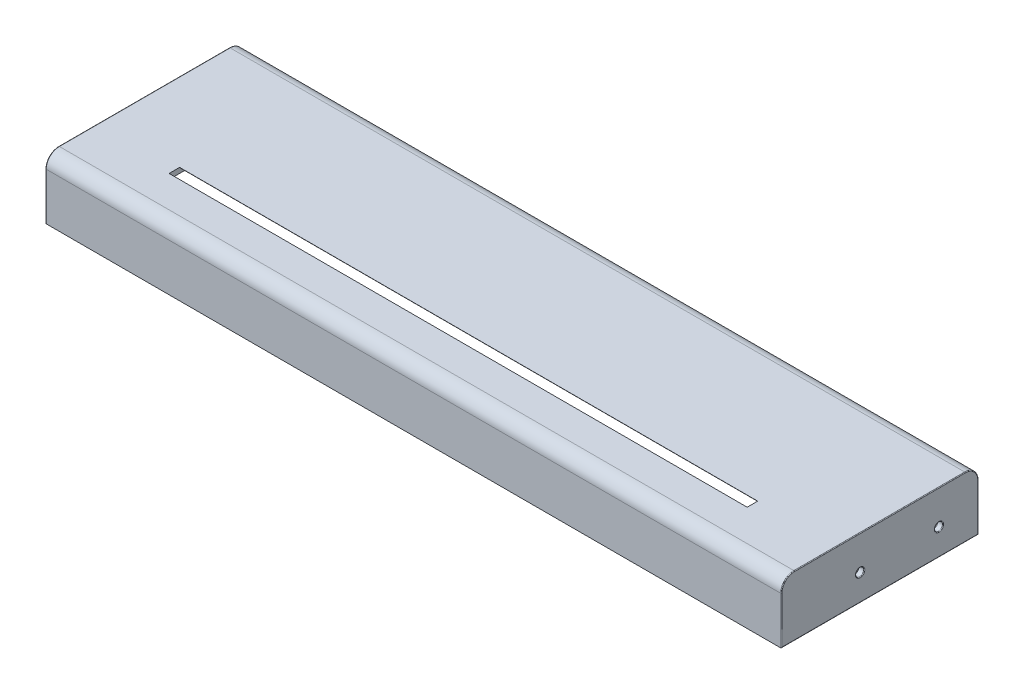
SolidWorks part; units mm, degrees
ref_plane "Piano frontale" through (0, 0, 0) normal (0, 0, 1) x (1, 0, 0)
ref_plane "Piano superiore" through (0, 0, 0) normal (0, 1, 0) x (1, 0, 0)
ref_plane "Piano destro" through (0, 0, 0) normal (1, 0, 0) x (0, 0, -1)
sketch "Schizzo1" plane through (0, 0, 0) normal (1, 0, 0) x (0, 0, -1)
  line L0 (-7.5, 10) -> (22.5, 10) construction
  line L1 (-32.5, 34) -> (32.5, 34)
  line L2 (-37.5, 29) -> (-37.5, 11)
  line L3 (7.5, 0) -> (7.5, 10) construction
  line L4 (37.5, 29) -> (37.5, 11)
  line L5 (-37.5, 0) -> (37.5, 0) construction
  line L6 (-37.5, 11) -> (37.5, 11)
  line L7 (37.5, 11) -> (37.5, 0) construction
  line L8 (-37.5, 0) -> (-37.5, 11) construction
  circle A0 centre (-7.5, 10) radius 1.55 construction
  arc A1 (-32.5, 34) -> (-37.5, 29) centre (-32.5, 29) ccw
  arc A2 (32.5, 34) -> (37.5, 29) centre (32.5, 29) cw
  circle A3 centre (22.5, 10) radius 1.55 construction
  point P1 (0, 0)
  dimension "D1" = 34
  dimension "D3" = 5
  dimension "D4" = 3.1
  dimension "D2" = 75
  dimension "D5" = 10
  dimension "D6" = 30
  dimension "D7" = 30
  dimension "D8" = 11
extrude "Estrusione-Estrusione1" add sketch "Schizzo1" along normal blind 280
shell "Svuota1" thickness 2
sketch "Schizzo2" plane through (0, 34, 0) normal (0, 1, 0) x (1, 0, 0)
  line L0 (140, -18.5) -> (140, 37.5) construction
  line L1 (30, -20.5) -> (250, -20.5)
  line L2 (30, -20.5) -> (30, -16.5)
  line L3 (30, -16.5) -> (250, -16.5)
  line L4 (250, -20.5) -> (250, -16.5)
  line L5 (30, -20.5) -> (250, -16.5) construction
  line L6 (30, -16.5) -> (250, -20.5) construction
  line L7 (280, 37.5) -> (0, 37.5) construction
  point P0 (140, -18.5)
  dimension "D1" = 4
  dimension "D2" = 220
  dimension "D3" = 56
extrude "Taglio-Estrusione1" cut sketch "Schizzo2" against normal blind 10
sketch "Schizzo3" plane through (280, 0, 0) normal (1, 0, 0) x (0, 0, -1)
  line L0 (-7.5, 21) -> (22.5, 21) construction
  line L1 (7.5, 21) -> (7.5, 0) construction
  line L3 (37.5, 11) -> (37.5, 0) construction
  line L4 (37.5, 0) -> (7.5, 0) construction
  circle A0 centre (22.5, 21) radius 1.55
  circle A1 centre (-7.5, 21) radius 1.55
  dimension "D1" = 3.1
  dimension "D2" = 30
  dimension "D3" = 21
extrude "Taglio-Estrusione2" cut sketch "Schizzo3" against normal up to next
fillet "Raccordo1" radius 5 2 edges at (140, 32, 20.5) (140, 32, 16.5)
sketch "Schizzo4" plane through (0, 0, 0) normal (-1, 0, 0) x (0, 0, 1)
  line L0 (-22.5, 21) -> (7.5, 21) construction
  line L1 (-7.5, 21) -> (-7.5, 0) construction
  line L3 (0, 0) -> (-7.5, 0) construction
  circle A0 centre (-22.5, 21) radius 1.55
  circle A1 centre (7.5, 21) radius 1.55
  point P7 (0, 0)
  dimension "D3" = 3.1
  dimension "D1" = 21
  dimension "D2" = 30
  dimension "D4" = 7.5
extrude "Taglio-Estrusione3" cut sketch "Schizzo4" against normal up to next
fillet "Raccordo2" radius 0.25 16 edges at (280, 34, 0) (280, 32.5355, -36.0355) (280, 20, -37.5) (280, 20, 37.5) (280, 32.5355, 36.0355) (280, 21, -24.05) (280, 21, 5.95) (0, 20, 37.5) (0, 20, -37.5) (0, 32.5355, -36.0355) (0, 34, 0) (0, 32.5355, 36.0355) (0, 21, -20.95) (0, 21, 9.05) (280, 11, 0) (0, 11, 0)
